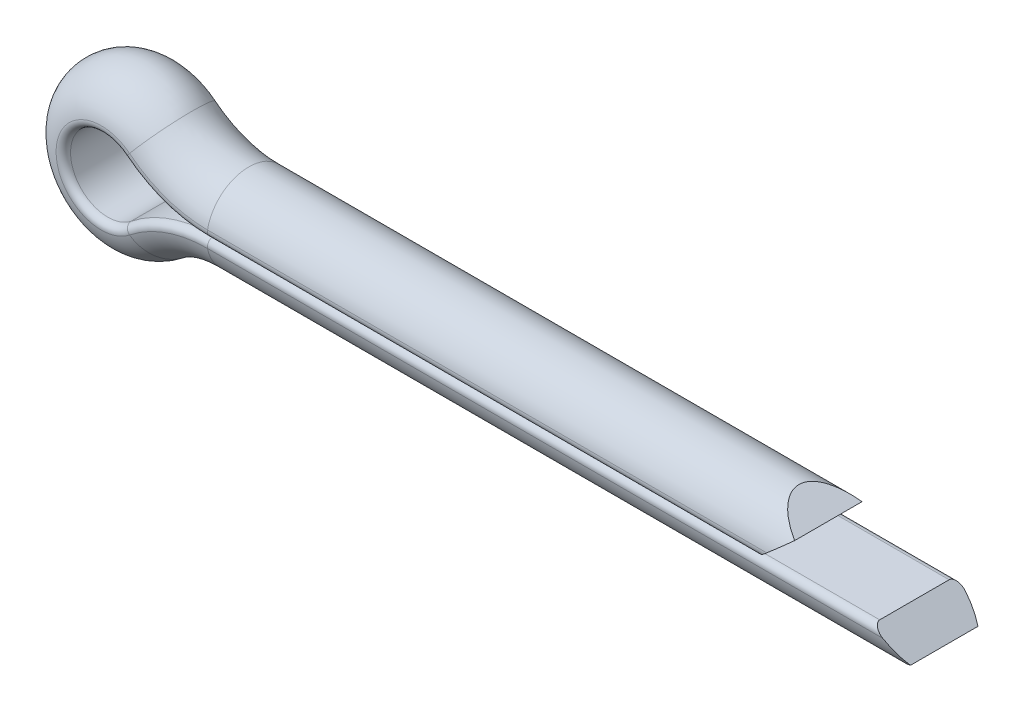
SolidWorks part; units mm, degrees
ref_plane "Front Plane" through (0, 0, 0) normal (0, 0, 1) x (1, 0, 0)
ref_plane "Top Plane" through (0, 0, 0) normal (0, 1, 0) x (1, 0, 0)
ref_plane "Right Plane" through (0, 0, 0) normal (1, 0, 0) x (0, 0, -1)
sketch "PathSke" plane through (0, 0, 0) normal (0, 0, 1) x (1, 0, 0)
  line L0 (0, 0) -> (38.8652, 0) construction
  line L1 (0, 0) -> (0, 12.2501) construction
  line L2 (3.665, 0) -> (3.665, 12.2501) construction
  line L3 (3.665, 1.45) -> (23.665, 1.45)
  line L4 (3.665, -1.45) -> (27.665, -1.45)
  line L5 (0, 0) -> (-2.735, 0) construction
  arc A0 (1.7079, 2.1362) -> (1.7079, -2.1362) centre (0, 0) ccw
  arc A1 (3.665, 1.45) -> (1.7079, 2.1362) centre (3.665, 4.584) cw
  arc A2 (3.665, -1.45) -> (1.7079, -2.1362) centre (3.665, -4.584) ccw
  dimension "Head_dia" = 5.47
  dimension "Head_height" = 6.4
  dimension "Diameter" = 2.9
  dimension "Length" = 20
  dimension "Tip_offset" = 4
ref_plane "SectionPlane" through (23.665, 1.45, 0) normal (1, 0, 0) x (0, 0, -1)
sketch "SectionSke" plane through (23.665, 1.45, 0) normal (1, 0, 0) x (0, 0, -1)
  line L0 (0, -1.45) -> (0, 8.6928) construction
  line L1 (0, -1.45) -> (0, 10.8001) construction
  line L2 (-1.45, -1.45) -> (1.45, -1.45) construction
  line L3 (-1.1977, -1.448) -> (1.1977, -1.448)
  arc A0 (1.4235, -1.1743) -> (-1.4235, -1.1743) centre (0, -1.45) ccw
  arc A1 (-1.1977, -1.448) -> (-1.4235, -1.1743) centre (-1.1977, -1.218) cw
  arc A2 (1.4235, -1.1743) -> (1.1977, -1.448) centre (1.1977, -1.218) cw
  dimension "D1" = 0.002
  dimension "Diameter" = 2.9
  dimension "Radius" = 0.23
sweep "BaseBody" add profiles "SectionSke" path "PathSke"
sketch "ConeCutSke" plane through (0, 0, 0) normal (0, 0, 1) x (1, 0, 0)
  line L0 (0, 0) -> (34.6884, 0) construction
  line L1 (22.6339, 1.46) -> (27.675, 1.46)
  line L2 (27.675, 1.46) -> (27.675, -1.46)
  line L3 (23.665, 1.45) -> (3.665, 1.45) construction
  line L4 (22.6339, 1.46) -> (23.665, 0.8629)
  line L5 (23.665, 0.2757) -> (23.665, 1.45) construction
  line L6 (23.665, 0.8629) -> (22.6339, 0)
  line L7 (22.6339, 0) -> (26.6339, 0)
  line L8 (26.6339, 0) -> (27.665, -0.8629)
  line L9 (27.665, -1.45) -> (27.665, -0.2757) construction
  line L10 (27.665, -0.8629) -> (26.6339, -1.46)
  line L11 (26.6339, -1.46) -> (27.675, -1.46)
  point P19 (27.675, 0)
  dimension "D1" = 0.01
  dimension "D2" = 70
  dimension "D3" = 70
  dimension "D4" = 0.01
extrude "ConeCut" cut sketch "ConeCutSke" against normal through all and the other way through all
equation "\"Diameter@SectionSke\" = \"Diameter@PathSke\""
